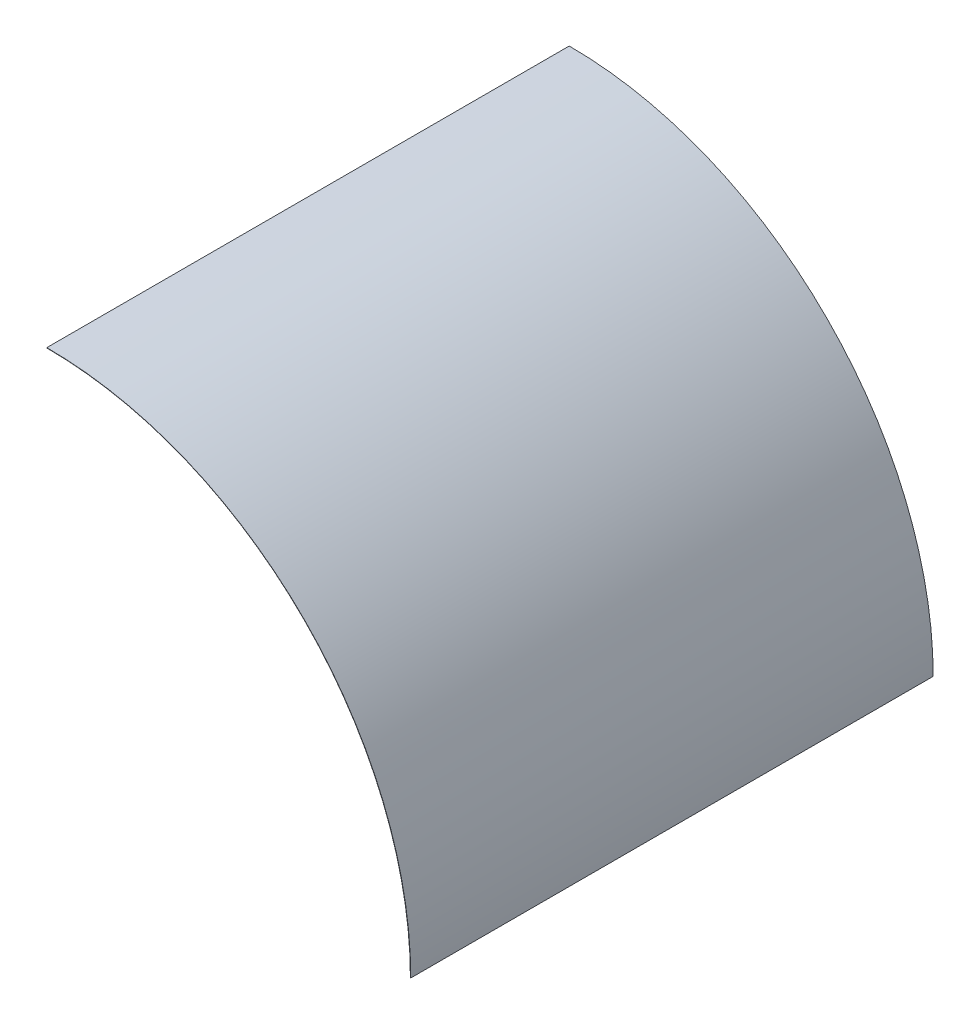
SolidWorks part; units mm, degrees
ref_plane "Front Plane" through (0, 0, 0) normal (0, 0, 1) x (1, 0, 0)
ref_plane "Top Plane" through (0, 0, 0) normal (0, 1, 0) x (1, 0, 0)
ref_plane "Right Plane" through (0, 0, 0) normal (1, 0, 0) x (0, 0, -1)
sketch "Sketch1" plane through (0, 0, 0) normal (0, 0, 1) x (1, 0, 0)
  line L0 (0, 0) -> (0, 45.174) construction
  line L1 (0, 0) -> (40.8023, 0) construction
  line L2 (0, 2090) -> (0, 2088)
  line L3 (2090, 0) -> (2088, 0)
  arc A0 (0, 2088) -> (2088, 0) centre (0, 0) cw
  arc A1 (0, 2090) -> (2090, 0) centre (0, 0) cw
  dimension "D1" = 2088
  dimension "D2" = 2
extrude "Boss-Extrude1" add sketch "Sketch1" against normal blind 3000
